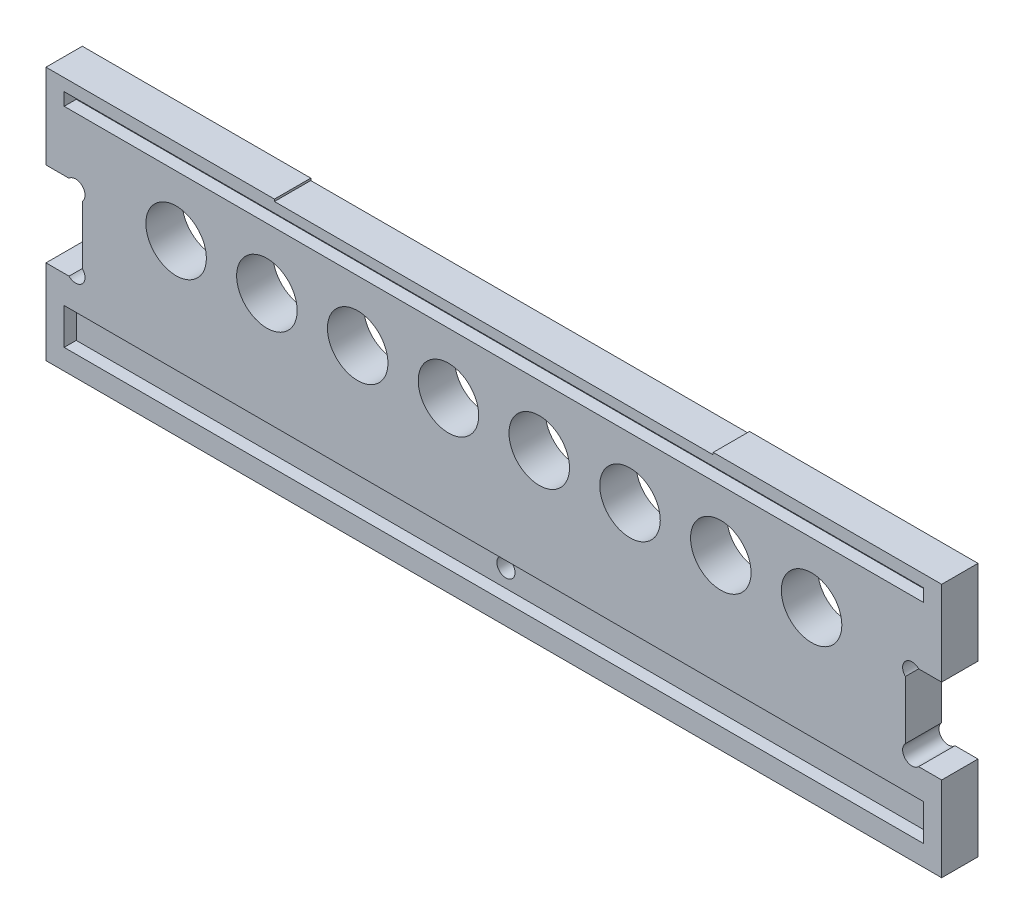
SolidWorks part; units mm, degrees
ref_plane "Plan de face" through (0, 0, 0) normal (0, 0, 1) x (1, 0, 0)
ref_plane "Plan de dessus" through (0, 0, 0) normal (0, 1, 0) x (1, 0, 0)
ref_plane "Plan de droite" through (0, 0, 0) normal (1, 0, 0) x (0, 0, -1)
sketch "Esquisse1" plane through (0, 0, 0) normal (0, 0, 1) x (1, 0, 0)
  line L0 (-18.4854, 0) -> (174.0371, 0) construction
  line L1 (0, -14.575) -> (0, 70.5052) construction
  line L2 (-18.4854, 42) -> (174.0371, 42) construction
  line L3 (-49.4967, 21) -> (232.5709, 21) construction
  line L4 (6, 65.2215) -> (6, -6.5783) construction
  line L5 (-6.1176, 9.4) -> (153.5283, 9.4) construction
  line L6 (-6.1176, 3.4) -> (153.5309, 3.4) construction
  line L7 (141.5, 56.6286) -> (141.5, -12.2812) construction
  line L8 (-7.2936, 37.9) -> (161.4629, 37.9) construction
  line L9 (-7.2936, 40) -> (161.4629, 40) construction
  line L10 (142, 56.6286) -> (142, -3.0419) construction
  line L11 (148, 70.5052) -> (148, -14.575) construction
  line L12 (74, 61.2759) -> (74, -18.1878) construction
  line L13 (6.2304, 24.4) -> (145.746, 24.4) construction
  line L14 (0, 42) -> (37.75, 42)
  line L15 (6.5, 15.8677) -> (6.5, 70.5052) construction
  line L16 (0, 42) -> (0, 28)
  line L17 (0, 0) -> (148, 0)
  line L18 (148, 42) -> (148, 28)
  line L19 (21.5, 30.0552) -> (21.5, 18.1829) construction
  line L20 (16.4844, 27.9) -> (139.4014, 27.9) construction
  line L21 (36.5, 30.0552) -> (36.5, 18.1829) construction
  line L22 (51.5, 30.0552) -> (51.5, 18.1829) construction
  line L23 (66.5, 30.0552) -> (66.5, 18.1829) construction
  line L24 (81.5, 30.0552) -> (81.5, 18.1829) construction
  line L25 (96.5, 30.0552) -> (96.5, 18.1829) construction
  line L26 (111.5, 30.0552) -> (111.5, 18.1829) construction
  line L27 (126.5, 30.0552) -> (126.5, 18.1829) construction
  line L28 (-9.5964, 28) -> (7.661, 28) construction
  line L29 (6, 28) -> (-0.7151, 21.2849) construction
  line L30 (0, 28) -> (3.808, 28)
  line L31 (0, 14) -> (3.808, 14)
  line L32 (6, 25.808) -> (6, 16.192)
  line L33 (0, 14) -> (0, 0)
  line L34 (148, 14) -> (144.192, 14)
  line L35 (142, 25.808) -> (142, 16.192)
  line L36 (148, 28) -> (144.192, 28)
  line L37 (148, 14) -> (148, 0)
  line L38 (37.75, 56.6286) -> (37.75, 38.8192) construction
  line L39 (110.25, 56.6286) -> (110.25, 38.8192) construction
  line L40 (16.4844, 41.65) -> (133.5022, 41.65) construction
  line L41 (-7.2936, 6.4) -> (158.0721, 6.4) construction
  line L42 (110.25, 42) -> (110.25, 41.65)
  line L43 (37.75, 41.65) -> (37.75, 42)
  line L44 (37.75, 41.65) -> (110.25, 41.65)
  line L45 (110.25, 42) -> (148, 42)
  circle A0 centre (74, 6.3976) radius 1.5
  circle A1 centre (21.5, 27.8993) radius 5
  circle A2 centre (36.5, 27.8993) radius 5
  circle A3 centre (51.5, 27.8993) radius 5
  circle A4 centre (66.5, 27.8993) radius 5
  circle A5 centre (81.5, 27.8993) radius 5
  circle A6 centre (96.5, 27.8993) radius 5
  circle A7 centre (111.5, 27.8993) radius 5
  circle A8 centre (126.5, 27.8993) radius 5
  arc A9 (6, 25.808) -> (3.808, 28) centre (4.904, 26.904) ccw
  arc A10 (6, 16.192) -> (3.808, 14) centre (4.904, 15.096) cw
  arc A11 (142, 16.192) -> (144.192, 14) centre (143.096, 15.096) ccw
  arc A12 (142, 25.808) -> (144.192, 28) centre (143.096, 26.904) cw
  dimension "D10" = 15
  dimension "D12" = 7
  dimension "D14" = 0.35
  dimension "D16" = 3
  dimension "D17" = 36.25
  dimension "D6" = 15
  dimension "D11" = 3.5
  dimension "D2" = 0.5
  dimension "D3" = 135
  dimension "D4" = 0.5
  dimension "D5" = 6
  dimension "D7" = 2
  dimension "D8" = 6
  dimension "D9" = 2.1
  dimension "D13" = 45
  dimension "D15" = 36.25
extrude "Extrusion1" add sketch "Esquisse1" along normal blind 6
sketch "Esquisse2" plane through (0, 0, 6) normal (0, 0, 1) x (1, 0, 0)
  line L0 (-3.4366, 3.4) -> (153.5234, 3.4) construction
  line L1 (-3.4366, 9.4) -> (153.5234, 9.4) construction
  line L2 (-3.4366, 37.9) -> (153.5234, 37.9) construction
  line L3 (-3.4366, 40) -> (153.5234, 40) construction
  line L4 (3, 49.9286) -> (3, -10.6391) construction
  line L5 (145, 46.2854) -> (145, -3.201) construction
  line L6 (0, 45.2228) -> (0, -3.201) construction
  line L7 (148, 45.2228) -> (148, -5.9334) construction
  line L8 (-5.4366, 42) -> (149.5966, 42) construction
  line L9 (149.5966, 0) -> (-3.4366, 0) construction
  line L11 (3, 40) -> (145, 40)
  line L12 (3, 40) -> (3, 37.9)
  line L13 (3, 37.9) -> (145, 37.9)
  line L14 (145, 40) -> (145, 37.9)
  line L15 (3, 9.4) -> (145, 9.4)
  line L16 (3, 9.4) -> (3, 3.4)
  line L17 (3, 3.4) -> (145, 3.4)
  line L18 (145, 9.4) -> (145, 3.4)
  dimension "D1" = 3
  dimension "D2" = 3.4
  dimension "D3" = 6
  dimension "D4" = 2
  dimension "D5" = 2.1
  dimension "D6" = 3
extrude "Enlèv. mat.-Extru.1" cut sketch "Esquisse2" against normal blind 2
